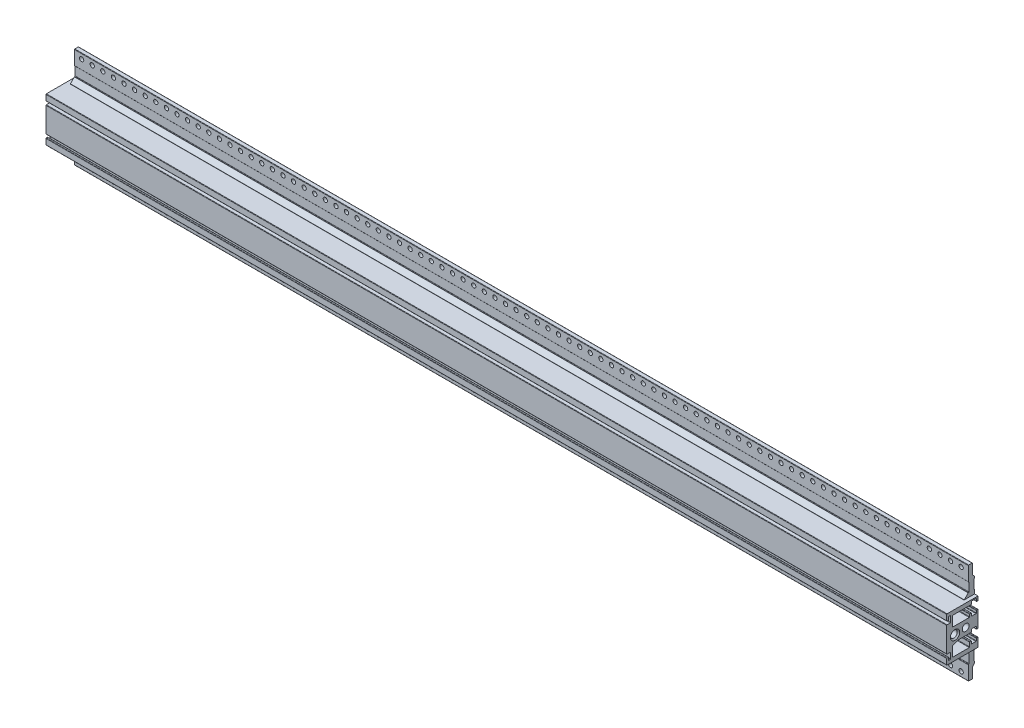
SolidWorks part; units mm, degrees
ref_plane "前视基准面" through (0, 0, 0) normal (0, 0, 1) x (1, 0, 0)
ref_plane "上视基准面" through (0, 0, 0) normal (0, 1, 0) x (1, 0, 0)
ref_plane "右视基准面" through (0, 0, 0) normal (1, 0, 0) x (0, 0, -1)
sketch "草图2" plane through (0, 0, 0) normal (1, 0, 0) x (0, 0, -1)
  line L0 (8.2, 24.1) -> (9.8, 24.1)
  line L1 (-3.8, 10.65) -> (5.9172, 10.65)
  line L2 (7.2, 5.2) -> (7.7, 5.2)
  line L3 (10.4, 5.2) -> (10.8, 5.2)
  line L4 (-1, 3.8) -> (6.8, 3.8)
  line L5 (8.1, 3.8) -> (10, 3.8)
  line L6 (8.1, 10.1) -> (10, 10.1)
  line L7 (-1, 8.7) -> (7.7, 8.7)
  line L8 (10.4, 8.7) -> (10.8, 8.7)
  line L9 (-3.8, 7.65) -> (-3.3, 7.65)
  line L10 (-2.9, 9.15) -> (-2.3, 9.15)
  line L11 (-3.8, 6.1) -> (-2.3, 6.1)
  line L12 (11, 18.0172) -> (11, 17.3)
  line L13 (11, 12.4627) -> (11, 8.9)
  line L14 (10.2, 9.9) -> (10.2, 8.9)
  line L15 (11, 5) -> (11, 1.325)
  line L16 (11, 1.025) -> (11, 0.15)
  line L17 (10.2, 9) -> (10.2, 8.9)
  line L18 (10.2, 5) -> (10.2, 4)
  line L19 (11, 0.15) -> (11, -2.65)
  line L20 (11, -6.55) -> (11, -12.45)
  line L21 (10.2, -1.65) -> (10.2, -2.65)
  line L22 (10.2, -6.55) -> (10.2, -7.55)
  line L23 (7, -6.55) -> (7, -8.5)
  line L24 (7.9, 9.9) -> (7.9, 8.9)
  line L25 (7.9, 5) -> (7.9, 4)
  line L26 (7.9, -1.65) -> (7.9, -2.65)
  line L27 (7.9, -6.55) -> (7.9, -7.55)
  line L28 (-1.2, 8.5) -> (-1.2, 4)
  line L29 (-1.2, -3.9892) -> (-1.2, -8.5)
  line L30 (11, -17.2873) -> (11, -18.0586)
  line L31 (10.7, 16.9127) -> (10.7, 12.85)
  line L32 (10.7, -12.8373) -> (10.7, -16.9)
  line L33 (10, 23.9) -> (10, 19.1828)
  line L34 (10, -19.1828) -> (10, -23.9)
  line L35 (8, 23.9) -> (8, 17.2873)
  line L36 (7, 5) -> (7, 4)
  line L38 (8.3, 16.9) -> (8.3, 12.85)
  line L39 (8.3, -12.85) -> (8.3, -16.9)
  line L40 (9.8, -24.1) -> (8.2, -24.1)
  line L41 (5.9172, -10.65) -> (-3.8, -10.65)
  line L42 (6.8, -8.7) -> (-1, -8.7)
  line L43 (10.7, -2.85) -> (10.5, -2.85)
  line L44 (11, 1.025) -> (10.85, 1.175)
  line L45 (11, 1.325) -> (10.85, 1.175)
  line L46 (10.8, -6.35) -> (10.4, -6.35)
  line L47 (7.7, -6.35) -> (7.2, -6.35)
  line L48 (10.8, -2.85) -> (10.4, -2.85)
  line L49 (7.7, -2.85) -> (1.5358, -2.85)
  line L50 (10, -1.45) -> (8.1, -1.45)
  line L51 (10, -7.75) -> (8.1, -7.75)
  line L52 (-3.3, -7.65) -> (-3.8, -7.65)
  line L53 (-2.3, -9.15) -> (-2.9, -9.15)
  line L54 (-2.3, -6.1) -> (-3.8, -6.1)
  line L55 (-4, -10.45) -> (-4, -7.85)
  line L56 (-4, -5.9) -> (-4, 5.9)
  line L57 (-4, 7.85) -> (-4, 10.45)
  line L58 (-3.1, -8.95) -> (-3.1, -7.85)
  line L59 (-3.1, 7.85) -> (-3.1, 8.95)
  line L60 (-2.1, -8.95) -> (-2.1, -6.3)
  line L61 (-2.1, 6.3) -> (-2.1, 8.95)
  line L62 (10.0586, -19.0414) -> (10.9707, -18.1293)
  line L63 (10.0586, 19.0414) -> (10.9414, 18.1586)
  line L64 (6.0586, 10.7086) -> (7.9418, 12.5918)
  line L65 (-1.0695, -3.8017) -> (1.4664, -2.8625)
  line L66 (8, -17.2873) -> (8, -23.9)
  line L68 (6.0586, -10.7086) -> (7.9418, -12.5918)
  arc A0 (8.3, 16.9) -> (8.15, 17.0936) centre (8.1, 16.9) ccw
  arc A1 (8, 17.2873) -> (8.15, 17.0936) centre (8.2, 17.2873) ccw
  arc A2 (10.85, 17.1064) -> (11, 17.3) centre (10.8, 17.3) ccw
  arc A3 (10.85, 17.1064) -> (10.7, 16.9127) centre (10.9, 16.9127) ccw
  arc A4 (5.9172, 10.65) -> (6.0586, 10.7086) centre (5.9172, 10.85) ccw
  arc A5 (-3.8, 10.65) -> (-4, 10.45) centre (-3.8, 10.45) ccw
  arc A6 (7.2, 5.2) -> (7, 5) centre (7.2, 5) ccw
  arc A7 (10.4, 5.2) -> (10.2, 5) centre (10.4, 5) ccw
  arc A8 (-1.2, 4) -> (-1, 3.8) centre (-1, 4) ccw
  arc A9 (10, 3.8) -> (10.2, 4) centre (10, 4) ccw
  arc A10 (7.9, 4) -> (8.1, 3.8) centre (8.1, 4) ccw
  arc A11 (10.2, 9.9) -> (10, 10.1) centre (10, 9.9) ccw
  arc A12 (7.7, 8.7) -> (7.9, 8.9) centre (7.7, 8.9) ccw
  arc A13 (-1, 8.7) -> (-1.2, 8.5) centre (-1, 8.5) ccw
  arc A14 (-3.3, 7.65) -> (-3.1, 7.85) centre (-3.3, 7.85) ccw
  arc A15 (-2.9, 9.15) -> (-3.1, 8.95) centre (-2.9, 8.95) ccw
  arc A16 (-2.3, 6.1) -> (-2.1, 6.3) centre (-2.3, 6.3) ccw
  arc A17 (8.0916, 12.6502) -> (8.3, 12.85) centre (8.1, 12.85) ccw
  arc A18 (8.0916, 12.6502) -> (7.9418, 12.5918) centre (8.0832, 12.4504) ccw
  arc A19 (10.7, 12.85) -> (10.85, 12.6564) centre (10.9, 12.85) ccw
  arc A20 (11, 12.4627) -> (10.85, 12.6564) centre (10.8, 12.4627) ccw
  arc A21 (11, 18.0172) -> (10.9414, 18.1586) centre (10.8, 18.0172) ccw
  arc A22 (10.8, 8.7) -> (11, 8.9) centre (10.8, 8.9) ccw
  arc A23 (11, 5) -> (10.8, 5.2) centre (10.8, 5) ccw
  arc A24 (10.2, 8.9) -> (10.4, 8.7) centre (10.4, 8.9) ccw
  arc A25 (10.2, -2.65) -> (10.4, -2.85) centre (10.4, -2.65) ccw
  arc A26 (10.4, -6.35) -> (10.2, -6.55) centre (10.4, -6.55) ccw
  arc A27 (7.2, -6.35) -> (7, -6.55) centre (7.2, -6.55) ccw
  arc A28 (6.8, -8.7) -> (7, -8.5) centre (6.8, -8.5) ccw
  arc A29 (8.1, 10.1) -> (7.9, 9.9) centre (8.1, 9.9) ccw
  arc A30 (7.9, 5) -> (7.7, 5.2) centre (7.7, 5) ccw
  arc A31 (8.1, -1.45) -> (7.9, -1.65) centre (8.1, -1.65) ccw
  arc A32 (7.9, -6.55) -> (7.7, -6.35) centre (7.7, -6.55) ccw
  arc A33 (7.9, -7.55) -> (8.1, -7.75) centre (8.1, -7.55) ccw
  arc A34 (-1.0695, -3.8017) -> (-1.2, -3.9892) centre (-1, -3.9892) ccw
  arc A35 (10, 23.9) -> (9.8, 24.1) centre (9.8, 23.9) ccw
  arc A36 (9.8, -24.1) -> (10, -23.9) centre (9.8, -23.9) ccw
  arc A37 (10.0586, -19.0414) -> (10, -19.1828) centre (10.2, -19.1828) ccw
  arc A38 (8.2, 24.1) -> (8, 23.9) centre (8.2, 23.9) ccw
  arc A39 (6.8, 3.8) -> (7, 4) centre (6.8, 4) ccw
  arc A40 (8, -23.9) -> (8.2, -24.1) centre (8.2, -23.9) ccw
  arc A41 (10.7, -16.9) -> (10.85, -17.0936) centre (10.9, -16.9) ccw
  arc A42 (11, -17.2873) -> (10.85, -17.0936) centre (10.8, -17.2873) ccw
  arc A43 (8.15, -17.0936) -> (8.3, -16.9) centre (8.1, -16.9) ccw
  arc A44 (8.15, -17.0936) -> (8, -17.2873) centre (8.2, -17.2873) ccw
  arc A45 (-4, -10.45) -> (-3.8, -10.65) centre (-3.8, -10.45) ccw
  arc A46 (-1.2, -8.5) -> (-1, -8.7) centre (-1, -8.5) ccw
  arc A47 (11, -6.55) -> (10.8, -6.35) centre (10.8, -6.55) ccw
  arc A48 (10.8, -2.85) -> (11, -2.65) centre (10.8, -2.65) ccw
  arc A49 (7.7, -2.85) -> (7.9, -2.65) centre (7.7, -2.65) ccw
  arc A50 (10.2, -1.65) -> (10, -1.45) centre (10, -1.65) ccw
  arc A51 (10, -7.75) -> (10.2, -7.55) centre (10, -7.55) ccw
  arc A52 (-3.1, -7.85) -> (-3.3, -7.65) centre (-3.3, -7.85) ccw
  arc A53 (-2.3, -9.15) -> (-2.1, -8.95) centre (-2.3, -8.95) ccw
  arc A54 (-2.1, -6.3) -> (-2.3, -6.1) centre (-2.3, -6.3) ccw
  arc A55 (10.85, -12.6436) -> (11, -12.45) centre (10.8, -12.45) ccw
  arc A56 (10.85, -12.6436) -> (10.7, -12.8373) centre (10.9, -12.8373) ccw
  arc A57 (-3.8, -7.65) -> (-4, -7.85) centre (-3.8, -7.85) ccw
  arc A58 (-4, -5.9) -> (-3.8, -6.1) centre (-3.8, -5.9) ccw
  arc A59 (-3.8, 6.1) -> (-4, 5.9) centre (-3.8, 5.9) ccw
  arc A60 (-4, 7.85) -> (-3.8, 7.65) centre (-3.8, 7.85) ccw
  arc A61 (-3.1, -8.95) -> (-2.9, -9.15) centre (-2.9, -8.95) ccw
  arc A62 (-2.1, 8.95) -> (-2.3, 9.15) centre (-2.3, 8.95) ccw
  arc A63 (10.9707, -18.1293) -> (11, -18.0586) centre (10.9, -18.0586) ccw
  arc A64 (10, 19.1828) -> (10.0586, 19.0414) centre (10.2, 19.1828) ccw
  arc A65 (1.5358, -2.85) -> (1.4664, -2.8625) centre (1.5358, -3.05) ccw
  circle A66 centre (0, 0) radius 1.6
  arc A70 (5.9172, -10.65) -> (6.0586, -10.7086) centre (5.9172, -10.85) cw
  arc A71 (8.0916, -12.6502) -> (7.9418, -12.5918) centre (8.0832, -12.4504) cw
  arc A72 (8.0916, -12.6502) -> (8.3, -12.85) centre (8.1, -12.85) cw
extrude "凸台-拉伸1" add sketch "草图2" along normal mid plane 431.8
sketch "草图3" plane through (0, 0, 4) normal (0, 0, 1) x (1, 0, 0)
  line L0 (215.9, -10.65) -> (-215.9, -10.65) construction
  line L1 (215.9, -24.1) -> (214.25, -24.1)
  line L2 (215.9, -24.1) -> (215.9, -10.65)
  line L3 (215.9, -10.65) -> (214.25, -10.65)
  line L4 (214.25, -24.1) -> (214.25, -10.65)
  line L6 (0, 0) -> (0, -44.0064) construction
  line L8 (215.9, 24.1) -> (214.25, 24.1)
  line L9 (215.9, 24.1) -> (215.9, 10.65)
  line L10 (215.9, 10.65) -> (214.25, 10.65)
  line L11 (214.25, 24.1) -> (214.25, 10.65)
  line L12 (215.9, 10.65) -> (-215.9, 10.65) construction
  line L13 (-214.25, 24.1) -> (-214.25, 10.65)
  line L14 (-215.9, 10.65) -> (-214.25, 10.65)
  line L15 (-215.9, 24.1) -> (-215.9, 10.65)
  line L16 (-215.9, 24.1) -> (-214.25, 24.1)
  line L17 (-214.25, -24.1) -> (-214.25, -10.65)
  line L18 (-215.9, -10.65) -> (-214.25, -10.65)
  line L19 (-215.9, -24.1) -> (-215.9, -10.65)
  line L20 (-215.9, -24.1) -> (-214.25, -24.1)
  dimension "D1" = 1.65
extrude "切除-拉伸1" cut sketch "草图3" against normal through all
sketch "草图4" plane through (0, 0, -10) normal (0, 0, -1) x (-1, 0, 0)
  line L0 (-215.9, 10.65) -> (-215.9, 8.9) construction
  line L2 (-214.25, 24.1) -> (-234.25, 24.1) construction
  line L3 (-214.25, -24.1) -> (-234.25, -24.1) construction
  line L4 (-224.25, 24.1) -> (-224.25, -24.1) construction
  line L5 (-224.25, 0) -> (-201.0943, 0) construction
  circle A0 centre (-210.82, 21.65) radius 0.75
  circle A1 centre (-210.82, -21.65) radius 0.75
  circle A2 centre (-205.74, 21.65) radius 0.75
  circle A3 centre (-205.74, -21.65) radius 0.75
  circle A4 centre (-200.66, 21.65) radius 0.75
  circle A5 centre (-200.66, -21.65) radius 0.75
  circle A6 centre (-195.58, 21.65) radius 0.75
  circle A7 centre (-195.58, -21.65) radius 0.75
  circle A8 centre (-190.5, 21.65) radius 0.75
  circle A9 centre (-190.5, -21.65) radius 0.75
  circle A10 centre (-185.42, 21.65) radius 0.75
  circle A11 centre (-185.42, -21.65) radius 0.75
  circle A12 centre (-180.34, 21.65) radius 0.75
  circle A13 centre (-180.34, -21.65) radius 0.75
  circle A14 centre (-175.26, 21.65) radius 0.75
  circle A15 centre (-175.26, -21.65) radius 0.75
  circle A16 centre (-170.18, 21.65) radius 0.75
  circle A17 centre (-170.18, -21.65) radius 0.75
  circle A18 centre (-165.1, 21.65) radius 0.75
  circle A19 centre (-165.1, -21.65) radius 0.75
  circle A20 centre (-160.02, 21.65) radius 0.75
  circle A21 centre (-160.02, -21.65) radius 0.75
  circle A22 centre (-154.94, 21.65) radius 0.75
  circle A23 centre (-154.94, -21.65) radius 0.75
  circle A24 centre (-149.86, 21.65) radius 0.75
  circle A25 centre (-149.86, -21.65) radius 0.75
  circle A26 centre (-144.78, 21.65) radius 0.75
  circle A27 centre (-144.78, -21.65) radius 0.75
  circle A28 centre (-139.7, 21.65) radius 0.75
  circle A29 centre (-139.7, -21.65) radius 0.75
  circle A30 centre (-134.62, 21.65) radius 0.75
  circle A31 centre (-134.62, -21.65) radius 0.75
  circle A32 centre (-129.54, 21.65) radius 0.75
  circle A33 centre (-129.54, -21.65) radius 0.75
  circle A34 centre (-124.46, 21.65) radius 0.75
  circle A35 centre (-124.46, -21.65) radius 0.75
  circle A36 centre (-119.38, 21.65) radius 0.75
  circle A37 centre (-119.38, -21.65) radius 0.75
  circle A38 centre (-114.3, 21.65) radius 0.75
  circle A39 centre (-114.3, -21.65) radius 0.75
  circle A40 centre (-109.22, 21.65) radius 0.75
  circle A41 centre (-109.22, -21.65) radius 0.75
  circle A42 centre (-104.14, 21.65) radius 0.75
  circle A43 centre (-104.14, -21.65) radius 0.75
  circle A44 centre (-99.06, 21.65) radius 0.75
  circle A45 centre (-99.06, -21.65) radius 0.75
  circle A46 centre (-93.98, 21.65) radius 0.75
  circle A47 centre (-93.98, -21.65) radius 0.75
  circle A48 centre (-88.9, 21.65) radius 0.75
  circle A49 centre (-88.9, -21.65) radius 0.75
  circle A50 centre (-83.82, 21.65) radius 0.75
  circle A51 centre (-83.82, -21.65) radius 0.75
  circle A52 centre (-78.74, 21.65) radius 0.75
  circle A53 centre (-78.74, -21.65) radius 0.75
  circle A54 centre (-73.66, 21.65) radius 0.75
  circle A55 centre (-73.66, -21.65) radius 0.75
  circle A56 centre (-68.58, 21.65) radius 0.75
  circle A57 centre (-68.58, -21.65) radius 0.75
  circle A58 centre (-63.5, 21.65) radius 0.75
  circle A59 centre (-63.5, -21.65) radius 0.75
  circle A60 centre (-58.42, 21.65) radius 0.75
  circle A61 centre (-58.42, -21.65) radius 0.75
  circle A62 centre (-53.34, 21.65) radius 0.75
  circle A63 centre (-53.34, -21.65) radius 0.75
  circle A64 centre (-48.26, 21.65) radius 0.75
  circle A65 centre (-48.26, -21.65) radius 0.75
  circle A66 centre (-43.18, 21.65) radius 0.75
  circle A67 centre (-43.18, -21.65) radius 0.75
  circle A68 centre (-38.1, 21.65) radius 0.75
  circle A69 centre (-38.1, -21.65) radius 0.75
  circle A70 centre (-33.02, 21.65) radius 0.75
  circle A71 centre (-33.02, -21.65) radius 0.75
  circle A72 centre (-27.94, 21.65) radius 0.75
  circle A73 centre (-27.94, -21.65) radius 0.75
  circle A74 centre (-22.86, 21.65) radius 0.75
  circle A75 centre (-22.86, -21.65) radius 0.75
  circle A76 centre (-17.78, 21.65) radius 0.75
  circle A77 centre (-17.78, -21.65) radius 0.75
  circle A78 centre (-12.7, 21.65) radius 0.75
  circle A79 centre (-12.7, -21.65) radius 0.75
  circle A80 centre (-7.62, 21.65) radius 0.75
  circle A81 centre (-7.62, -21.65) radius 0.75
  circle A82 centre (-2.54, 21.65) radius 0.75
  circle A83 centre (-2.54, -21.65) radius 0.75
  circle A84 centre (2.54, 21.65) radius 0.75
  circle A85 centre (2.54, -21.65) radius 0.75
  circle A86 centre (7.62, 21.65) radius 0.75
  circle A87 centre (7.62, -21.65) radius 0.75
  circle A88 centre (12.7, 21.65) radius 0.75
  circle A89 centre (12.7, -21.65) radius 0.75
  circle A90 centre (17.78, 21.65) radius 0.75
  circle A91 centre (17.78, -21.65) radius 0.75
  circle A92 centre (22.86, 21.65) radius 0.75
  circle A93 centre (22.86, -21.65) radius 0.75
  circle A94 centre (27.94, 21.65) radius 0.75
  circle A95 centre (27.94, -21.65) radius 0.75
  circle A96 centre (33.02, 21.65) radius 0.75
  circle A97 centre (33.02, -21.65) radius 0.75
  circle A98 centre (38.1, 21.65) radius 0.75
  circle A99 centre (38.1, -21.65) radius 0.75
  circle A100 centre (43.18, 21.65) radius 0.75
  circle A101 centre (43.18, -21.65) radius 0.75
  circle A102 centre (48.26, 21.65) radius 0.75
  circle A103 centre (48.26, -21.65) radius 0.75
  circle A104 centre (53.34, 21.65) radius 0.75
  circle A105 centre (53.34, -21.65) radius 0.75
  circle A106 centre (58.42, 21.65) radius 0.75
  circle A107 centre (58.42, -21.65) radius 0.75
  circle A108 centre (63.5, 21.65) radius 0.75
  circle A109 centre (63.5, -21.65) radius 0.75
  circle A110 centre (68.58, 21.65) radius 0.75
  circle A111 centre (68.58, -21.65) radius 0.75
  circle A112 centre (73.66, 21.65) radius 0.75
  circle A113 centre (73.66, -21.65) radius 0.75
  circle A114 centre (78.74, 21.65) radius 0.75
  circle A115 centre (78.74, -21.65) radius 0.75
  circle A116 centre (83.82, 21.65) radius 0.75
  circle A117 centre (83.82, -21.65) radius 0.75
  circle A118 centre (88.9, 21.65) radius 0.75
  circle A119 centre (88.9, -21.65) radius 0.75
  circle A120 centre (93.98, 21.65) radius 0.75
  circle A121 centre (93.98, -21.65) radius 0.75
  circle A122 centre (99.06, 21.65) radius 0.75
  circle A123 centre (99.06, -21.65) radius 0.75
  circle A124 centre (104.14, 21.65) radius 0.75
  circle A125 centre (104.14, -21.65) radius 0.75
  circle A126 centre (109.22, 21.65) radius 0.75
  circle A127 centre (109.22, -21.65) radius 0.75
  circle A128 centre (114.3, 21.65) radius 0.75
  circle A129 centre (114.3, -21.65) radius 0.75
  circle A130 centre (119.38, 21.65) radius 0.75
  circle A131 centre (119.38, -21.65) radius 0.75
  circle A132 centre (124.46, 21.65) radius 0.75
  circle A133 centre (124.46, -21.65) radius 0.75
  circle A134 centre (129.54, 21.65) radius 0.75
  circle A135 centre (129.54, -21.65) radius 0.75
  circle A136 centre (134.62, 21.65) radius 0.75
  circle A137 centre (134.62, -21.65) radius 0.75
  circle A138 centre (139.7, 21.65) radius 0.75
  circle A139 centre (139.7, -21.65) radius 0.75
  circle A140 centre (144.78, 21.65) radius 0.75
  circle A141 centre (144.78, -21.65) radius 0.75
  circle A142 centre (149.86, 21.65) radius 0.75
  circle A143 centre (149.86, -21.65) radius 0.75
  circle A144 centre (154.94, 21.65) radius 0.75
  circle A145 centre (154.94, -21.65) radius 0.75
  circle A146 centre (160.02, 21.65) radius 0.75
  circle A147 centre (160.02, -21.65) radius 0.75
  circle A148 centre (165.1, 21.65) radius 0.75
  circle A149 centre (165.1, -21.65) radius 0.75
  circle A150 centre (170.18, 21.65) radius 0.75
  circle A151 centre (170.18, -21.65) radius 0.75
  circle A152 centre (175.26, 21.65) radius 0.75
  circle A153 centre (175.26, -21.65) radius 0.75
  circle A154 centre (180.34, 21.65) radius 0.75
  circle A155 centre (180.34, -21.65) radius 0.75
  circle A156 centre (185.42, 21.65) radius 0.75
  circle A157 centre (185.42, -21.65) radius 0.75
  circle A158 centre (190.5, 21.65) radius 0.75
  circle A159 centre (190.5, -21.65) radius 0.75
  circle A160 centre (195.58, 21.65) radius 0.75
  circle A161 centre (195.58, -21.65) radius 0.75
  circle A162 centre (200.66, 21.65) radius 0.75
  circle A163 centre (200.66, -21.65) radius 0.75
  circle A164 centre (205.74, 21.65) radius 0.75
  circle A165 centre (205.74, -21.65) radius 0.75
  circle A166 centre (210.82, 21.65) radius 0.75
  circle A167 centre (210.82, -21.65) radius 0.75
  dimension "D1" = 1.5
  dimension "D2" = 5.08
  dimension "D3" = 20
  dimension "D4" = 43.3
  dimension "D6" = 5.08
  dimension "D5" = 84
extrude "切除-拉伸2" cut sketch "草图4" against normal through all
hole_wizard "M2.5 螺纹孔1" positions "3D草图1" profile "草图5" tap size "M2.5" standard "Gb"
sketch3d "3D草图1"
  line L0 (210.82, 21.65, -8) -> (210.82, 21.65, -10) construction
  line L1 (210.82, -21.65, -8) -> (210.82, -21.65, -10) construction
  point P0 (210.82, 21.65, -10)
  point P4 (210.82, -21.65, -10)
sketch "草图5" plane through (210.82, 21.65, -10) normal (1, 0, 0) x (0, 1, 0)
  line L0 (0, 0) -> (0, 14)
  line L1 (0, 14) -> (1.025, 14)
  line L2 (1.025, 14) -> (1.025, 0)
  line L5 (1.025, 0) -> (0, 0)
  line L11 (0, -6.35) -> (0, 107.95) construction
  dimension "通孔螺纹孔钻头直径" = 2.05
  dimension "通孔螺纹孔钻头深度" = 14
pattern_linear "阵列(线性)1" count 84 spacing 5.08 along (-1, 0, 0) of "M2.5 螺纹孔1"
hole_wizard "M4 螺纹孔1" positions "3D草图2" profile "草图6" tap size "M4" standard "Gb"
sketch3d "3D草图2"
  line L0 (215.9, 0, 0) -> (-215.9, 0, 0) construction
  point P0 (0, 0, 0)
  point P4 (-215.9, 0, 0)
  point P8 (215.9, 0, 0)
sketch "草图6" plane through (-215.9, 0, 0) normal (0, 1, 0) x (0, 0, 1)
  line L0 (0, 0) -> (0, 15.0914)
  line L1 (0, 15.0914) -> (1.65, 14.1)
  line L2 (1.65, 14.1) -> (1.65, 0)
  line L5 (1.65, 0) -> (0, 0)
  line L10 (0, 15.0914) -> (-1.65, 14.1) construction
  line L11 (0, -6.35) -> (0, 107.95) construction
  dimension "螺纹孔钻头直径" = 3.3
  dimension "螺纹孔钻头深度" = 14.1
  dimension "导头角度" = 118
chamfer "倒角1" distance 0.6 angle 45 2 edges at (215.9, 0, -1.65) (-215.9, 0, 1.65)
sketch "草图7" plane through (-215.9, 0, 0) normal (-1, 0, 0) x (0, 0, 1)
  circle A0 centre (-5.1, 0.5) radius 1.65
  circle A1 centre (0, 0) radius 1.65 construction
  circle A2 centre (0, 0) radius 2.25 construction
  dimension "D1" = 5.1
  dimension "D2" = 0.5
  dimension "D3" = 3.3
extrude "切除-拉伸3" cut sketch "草图7" against normal blind 20
sketch "草图8" plane through (-214.25, 0, 0) normal (-1, 0, 0) x (0, 0, 1)
  line L0 (-5.8819, -10.65) -> (-8, -10.65)
  line L1 (-11, -10.65) -> (3.8, -10.65) construction
  line L2 (-11, -10.65) -> (-5.9172, -10.65) construction
  line L3 (-8, -10.65) -> (-8, -13.2407)
  line L4 (-8, -13.2407) -> (-5.8819, -10.65)
  line L5 (-11, -12.45) -> (-11, -10.65) construction
  dimension "D1" = 3
extrude "切除-拉伸4" cut sketch "草图8" against normal through all
fillet "圆角1" radius 0.2 2 edges at (0, -12.6322, -8) (0, -10.65, -8)
sketch "草图9" plane through (215.9, 0, 0) normal (1, 0, 0) x (0, 0, -1)
  circle A0 centre (5.1, 0.5) radius 1.65
  circle A1 centre (0, 0) radius 2.25 construction
  dimension "D1" = 3.3
  dimension "D2" = 5.1
  dimension "D3" = 0.5
extrude "切除-拉伸5" cut sketch "草图9" against normal blind 20
